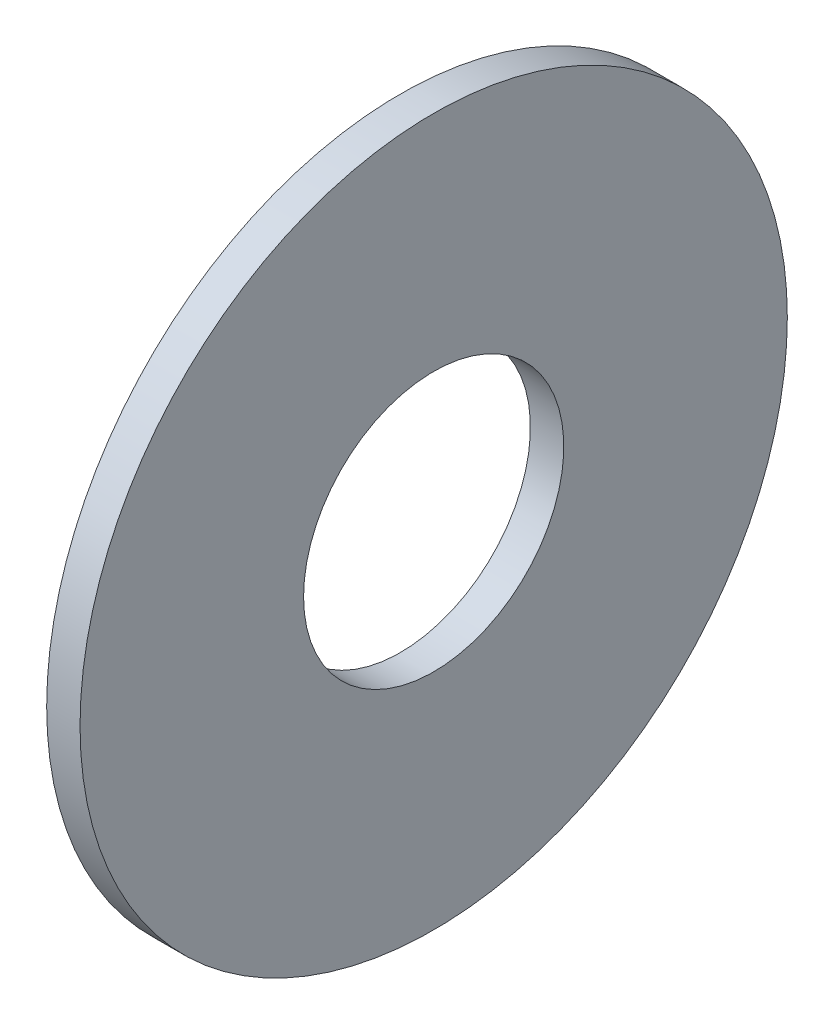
SolidWorks part; units mm, degrees
ref_plane "Plan de face" through (0, 0, 0) normal (0, 0, 1) x (1, 0, 0)
ref_plane "Plan de dessus" through (0, 0, 0) normal (0, 1, 0) x (1, 0, 0)
ref_plane "Plan de droite" through (0, 0, 0) normal (1, 0, 0) x (0, 0, -1)
sketch "Esquisse1" plane through (0, 0, 0) normal (0, 0, 1) x (1, 0, 0)
  line L0 (0, 97.5) -> (0, 265)
  line L1 (0, 265) -> (25, 265)
  line L2 (25, 265) -> (25, 97.5)
  line L3 (25, 97.5) -> (0, 97.5)
  line L5 (0, 0) -> (94.672, 0) construction
  dimension "D1" = 195
  dimension "D2" = 530
  dimension "D3" = 25
revolve "Révolution1" add sketch "Esquisse1" angle 360 about L5
